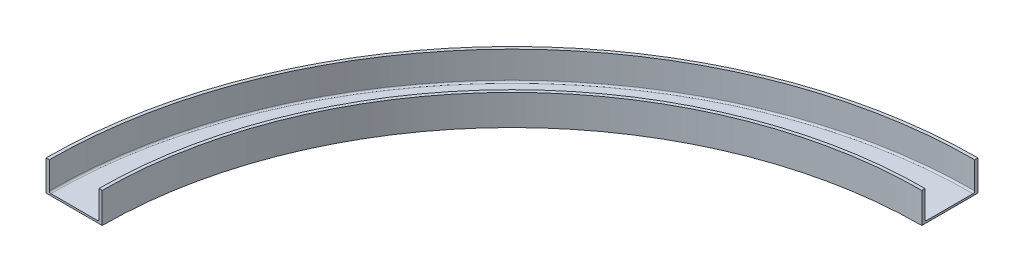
SolidWorks part; units mm, degrees
ref_plane "Front Plane" through (0, 0, 0) normal (0, 0, 1) x (1, 0, 0)
ref_plane "Top Plane" through (0, 0, 0) normal (0, 1, 0) x (1, 0, 0)
ref_plane "Right Plane" through (0, 0, 0) normal (1, 0, 0) x (0, 0, -1)
sketch "Sketch1" plane through (0, 0, 0) normal (0, 0, 1) x (1, 0, 0)
  line L0 (-76.2, 41.275) -> (-76.2, -41.275) construction
  line L1 (-76.2, -41.275) -> (76.2, -41.275) construction
  line L2 (76.2, -41.275) -> (76.2, 41.275) construction
  line L3 (67.31, -35.941) -> (-67.31, -35.941) construction
  line L4 (-67.31, -35.941) -> (-67.31, 41.275) construction
  line L6 (-67.31, 41.275) -> (-76.2, 41.275) construction
  line L7 (0, -41.275) -> (0, 0) construction
  line L8 (76.2, 41.275) -> (67.31, 41.275) construction
  line L9 (67.31, 41.275) -> (67.31, -35.941) construction
  line L10 (0, -35.941) -> (0, -41.275) construction
  point P4 (0, 0)
  point P11 (76.2, -35.941)
sketch "Sketch2" plane through (0, 0, 0) normal (1, 0, 0) x (0, 0, -1)
  line L0 (228.6, 41.275) -> (-228.6, 41.275) construction
  line L1 (0, -35.941) -> (0, 41.275) construction
  point P0 (-76.2, 41.275)
  point P4 (0, 41.275)
  point P6 (76.2, 41.275)
sketch "Sketch3" plane through (0, 0, 0) normal (0, 0, 1) x (1, 0, 0)
  line L6 (-76.2, 41.275) -> (-76.2, -41.275)
  line L7 (-76.2, -41.275) -> (76.2, -41.275)
  line L8 (76.2, -41.275) -> (76.2, 41.275)
  line L9 (76.2, 41.275) -> (67.31, 41.275)
  line L10 (67.31, 41.275) -> (67.31, -31.496)
  line L11 (62.865, -35.941) -> (-62.865, -35.941)
  line L12 (-67.31, -31.496) -> (-67.31, 41.275)
  line L13 (-67.31, 41.275) -> (-76.2, 41.275)
  arc A0 (67.31, -31.496) -> (62.865, -35.941) centre (62.865, -31.496) cw
  arc A1 (-62.865, -35.941) -> (-67.31, -31.496) centre (-62.865, -31.496) cw
  point P8 (67.31, -35.941)
  point P13 (-67.31, -35.941)
  point P23 (-67.31, 41.275)
  dimension "D1" = 4.445
sketch "Sketch9" plane through (0, 0, 0) normal (0, 1, 0) x (1, 0, 0)
  circle A0 centre (1186.97, 0) radius 1224.28 construction
  circle A1 centre (1186.97, 0) radius 1254.28
  point P7 (1186.97, 1254.28)
  dimension "D1" = 2448.56
  dimension "D2" = 30
sketch "Sketch10" plane through (0, 0, 0) normal (0, 0, 1) x (1, 0, 0)
  line L0 (1186.97, 0) -> (1186.97, 179.8385)
sweep "Sweep2" add profiles "Sketch3" path "Sketch9"
sketch "Sketch11" plane through (0, 0, 0) normal (0, 1, 0) x (1, 0, 0)
  line L0 (-450.8875, 0) -> (1186.97, 0)
  line L1 (1186.97, 0) -> (1186.97, 1939.4546)
  line L2 (1186.97, 1939.4546) -> (2729.3181, 1939.4546)
  line L3 (2729.3181, 1939.4546) -> (2729.3181, -1455.5435)
  line L4 (2729.3181, -1455.5435) -> (-450.8875, -1455.5435)
  line L5 (-450.8875, -1455.5435) -> (-450.8875, 0)
extrude "Cut-Extrude4" cut sketch "Sketch11" against normal through all both and the other way through all
equation "\"D2@Sketch2\"=\"D1@Sketch2\""
equation "\"D1@Sketch1\"=\"Outside Height@Sketch1\"/2"
equation "\"D1@Sketch2\"= \"Outside Width@Sketch1\" * 1"
